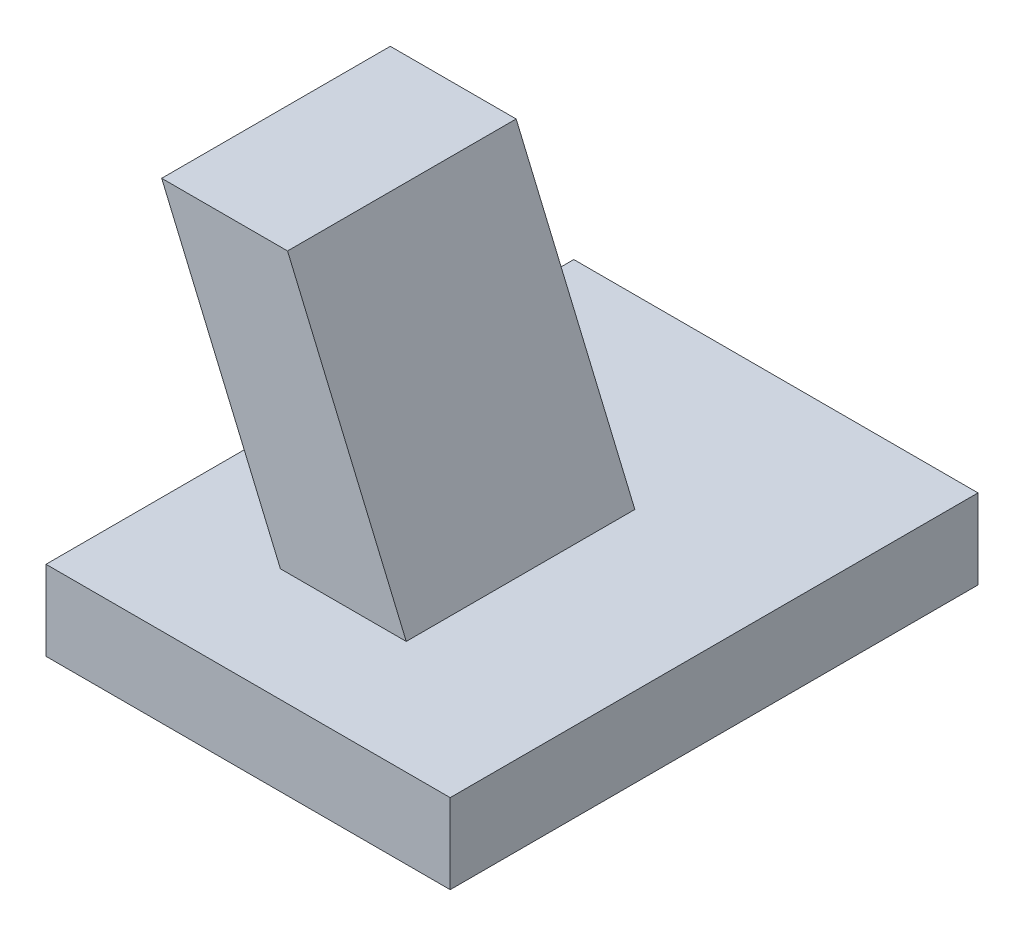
SolidWorks part; units mm, degrees
ref_plane "Front Plane" through (0, 0, 0) normal (0, 0, 1) x (1, 0, 0)
ref_plane "Top Plane" through (0, 0, 0) normal (0, 1, 0) x (1, 0, 0)
ref_plane "Right Plane" through (0, 0, 0) normal (1, 0, 0) x (0, 0, -1)
sketch "Sketch1" plane through (0, 0, 0) normal (0, 1, 0) x (1, 0, 0)
  line L0 (50.6824, -66.1847) -> (-50.6824, 66.1847) construction
  line L1 (-50.6824, -66.1847) -> (50.6824, -66.1847)
  line L2 (-50.6824, -66.1847) -> (-50.6824, 66.1847)
  line L3 (-50.6824, 66.1847) -> (50.6824, 66.1847)
  line L4 (50.6824, -66.1847) -> (50.6824, 66.1847)
extrude "Extrude1" add sketch "Sketch1" along normal blind 20
sketch "Sketch2" plane through (0, 20, 0) normal (0, 1, 0) x (1, 0, 0)
  line L1 (-20.3118, -37.7741) -> (11.2522, -37.7741)
  line L2 (-20.3118, -37.7741) -> (-20.3118, 19.557)
  line L3 (-20.3118, 19.557) -> (11.2522, 19.557)
  line L4 (11.2522, -37.7741) -> (11.2522, 19.557)
sketch "Sketch3" plane through (0, 0, 66.1847) normal (0, 0, 1) x (1, 0, 0)
  line L1 (-50.6824, 0) -> (-91.5848, 96.0781)
extrude "Boss-Extrude1" add sketch "Sketch2" along direction (-0.3917, 0.9201, 0) on the side of the normal blind 76
